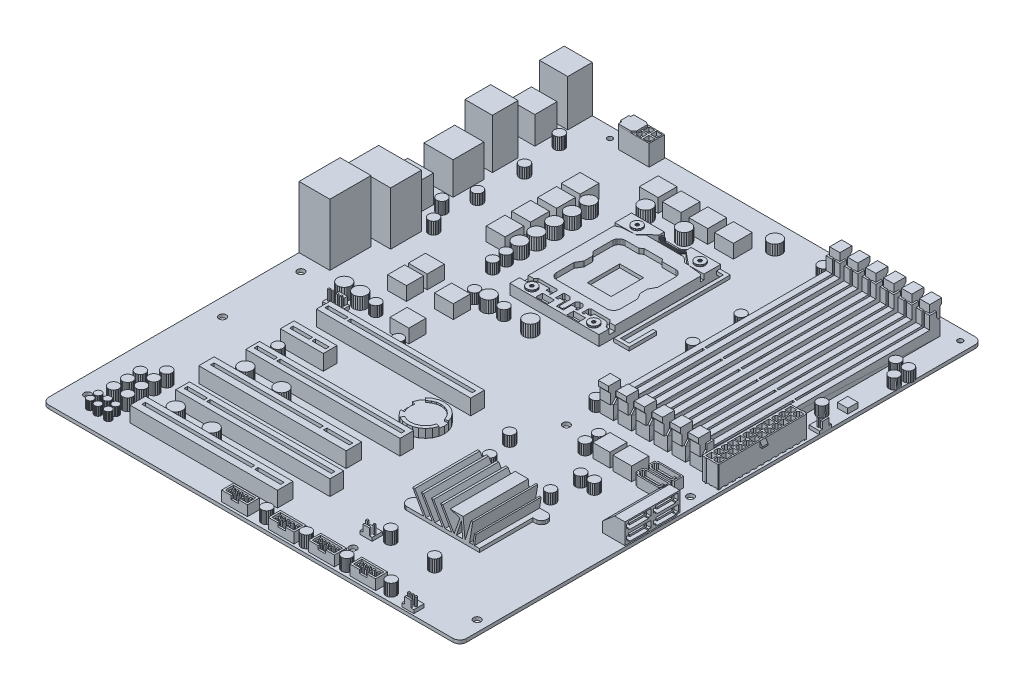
SolidWorks part; units mm, degrees
ref_plane "Front" through (0, 0, 0) normal (0, 0, 1) x (1, 0, 0)
ref_plane "Top" through (0, 0, 0) normal (0, 1, 0) x (1, 0, 0)
ref_plane "Right" through (0, 0, 0) normal (1, 0, 0) x (0, 0, -1)
imported_body "Imported1"
imported_body "Imported2"
imported_body "Imported3"
imported_body "Imported4"
imported_body "Imported5"
imported_body "Imported6"
imported_body "Imported7"
imported_body "Imported8"
imported_body "Imported9"
imported_body "Imported10"
imported_body "Imported11"
imported_body "Imported12"
imported_body "Surface-Imported4"
imported_body "Surface-Imported5"
imported_body "Surface-Imported6"
imported_body "Surface-Imported7"
imported_body "Surface-Imported20"
imported_body "Surface-Imported26"
imported_body "Surface-Imported27"
imported_body "Surface-Imported28"
imported_body "Surface-Imported29"
imported_body "Surface-Imported30"
imported_body "Surface-Imported31"
imported_body "Surface-Imported32"
imported_body "Surface-Imported33"
imported_body "Surface-Imported34"
imported_body "Surface-Imported35"
imported_body "Surface-Imported36"
imported_body "Surface-Imported37"
imported_body "Surface-Imported38"
imported_body "Surface-Imported39"
imported_body "Surface-Imported40"
imported_body "Surface-Imported41"
imported_body "Surface-Imported42"
imported_body "Surface-Imported43"
imported_body "Surface-Imported44"
imported_body "Surface-Imported45"
imported_body "Surface-Imported46"
imported_body "Surface-Imported47"
imported_body "Surface-Imported48"
imported_body "Surface-Imported49"
imported_body "Surface-Imported50"
imported_body "Surface-Imported51"
imported_body "Surface-Imported52"
imported_body "Surface-Imported53"
imported_body "Surface-Imported54"
imported_body "Surface-Imported55"
imported_body "Surface-Imported56"
imported_body "Surface-Imported57"
imported_body "Surface-Imported58"
imported_body "Surface-Imported59"
imported_body "Surface-Imported60"
imported_body "Surface-Imported61"
imported_body "Surface-Imported62"
imported_body "Surface-Imported63"
imported_body "Surface-Imported64"
imported_body "Surface-Imported65"
imported_body "Surface-Imported66"
imported_body "Surface-Imported67"
imported_body "Surface-Imported69"
imported_body "Surface-Imported70"
imported_body "Surface-Imported71"
imported_body "Surface-Imported72"
imported_body "Surface-Imported73"
imported_body "Surface-Imported74"
imported_body "Surface-Imported75"
imported_body "Surface-Imported76"
imported_body "Surface-Imported77"
imported_body "Surface-Imported78"
imported_body "Surface-Imported79"
imported_body "Surface-Imported80"
imported_body "Surface-Imported81"
imported_body "Surface-Imported82"
imported_body "Surface-Imported83"
imported_body "Surface-Imported84"
imported_body "Surface-Imported85"
imported_body "Surface-Imported86"
imported_body "Surface-Imported87"
imported_body "Surface-Imported88"
imported_body "Surface-Imported89"
imported_body "Surface-Imported90"
imported_body "Surface-Imported91"
imported_body "Surface-Imported92"
imported_body "Surface-Imported93"
imported_body "Surface-Imported94"
imported_body "Surface-Imported95"
imported_body "Surface-Imported96"
imported_body "Surface-Imported97"
imported_body "Surface-Imported98"
imported_body "Surface-Imported99"
imported_body "Surface-Imported100"
imported_body "Surface-Imported101"
imported_body "Surface-Imported102"
imported_body "Surface-Imported103"
imported_body "Surface-Imported104"
imported_body "Surface-Imported105"
imported_body "Surface-Imported106"
imported_body "Surface-Imported107"
imported_body "Surface-Imported108"
imported_body "Surface-Imported109"
imported_body "Surface-Imported110"
imported_body "Surface-Imported111"
imported_body "Surface-Imported112"
imported_body "Surface-Imported113"
imported_body "Surface-Imported114"
imported_body "Surface-Imported115"
imported_body "Surface-Imported116"
imported_body "Surface-Imported117"
imported_body "Surface-Imported118"
imported_body "Surface-Imported119"
imported_body "Surface-Imported120"
imported_body "Surface-Imported121"
imported_body "Surface-Imported122"
imported_body "Surface-Imported123"
imported_body "Surface-Imported124"
imported_body "Surface-Imported125"
imported_body "Surface-Imported126"
imported_body "Surface-Imported127"
imported_body "Surface-Imported128"
imported_body "Surface-Imported129"
imported_body "Surface-Imported130"
imported_body "Surface-Imported131"
imported_body "Surface-Imported132"
imported_body "Surface-Imported133"
imported_body "Surface-Imported134"
imported_body "Surface-Imported135"
imported_body "Surface-Imported136"
imported_body "Surface-Imported137"
imported_body "Surface-Imported138"
imported_body "Surface-Imported139"
imported_body "Surface-Imported140"
imported_body "Surface-Imported141"
imported_body "Surface-Imported142"
imported_body "Surface-Imported143"
imported_body "Surface-Imported144"
imported_body "Surface-Imported145"
imported_body "Surface-Imported146"
imported_body "Surface-Imported147"
imported_body "Surface-Imported148"
imported_body "Surface-Imported149"
imported_body "Surface-Imported150"
imported_body "Surface-Imported151"
imported_body "Surface-Imported152"
imported_body "Surface-Imported153"
imported_body "Surface-Imported154"
imported_body "Surface-Imported155"
imported_body "Surface-Imported156"
imported_body "Surface-Imported157"
imported_body "Surface-Imported158"
imported_body "Surface-Imported159"
imported_body "Surface-Imported160"
imported_body "Surface-Imported161"
imported_body "Surface-Imported162"
imported_body "Surface-Imported163"
imported_body "Surface-Imported164"
imported_body "Surface-Imported165"
imported_body "Surface-Imported166"
imported_body "Surface-Imported167"
surface "Surface-Plane1"
surface "Surface-Knit1"
surface "Surface-Plane2"
surface "Surface-Knit2"
surface "Surface-Plane3"
surface "Surface-Knit3"
surface "Surface-Plane4"
surface "Surface-Knit4"
surface "Surface-Plane5"
surface "Surface-Knit5"
surface "Surface-Plane6"
surface "Surface-Knit6"
surface "Surface-Plane7"
surface "Surface-Knit7"
surface "Surface-Plane8"
surface "Surface-Knit8"
surface "Surface-Plane9"
surface "Surface-Knit9"
surface "Surface-Plane10"
surface "Surface-Untrim1"
surface "Surface-Knit10"
surface "Surface-Plane11"
surface "Surface-Knit11"
surface "Surface-Knit12"
surface "Surface-Plane12"
surface "Surface-Knit13"
surface "Surface-Plane13"
surface "Surface-Knit14"
surface "Surface-Plane14"
surface "Surface-Knit15"
surface "Surface-Plane15"
surface "Surface-Knit16"
surface "Surface-Knit17"
pattern_linear "LPattern1" count 6 spacing 10.4927 along (-1, 0, 0)
imported_body "Surface-Imported1"
move or copy body "Body-Move/Copy8" bodies to move or copy 497 copy no translate (1114.9679, -426.0449, -345.9483)
move or copy body "Body-Move/Copy7" bodies to move or copy 498 placed by mates yes
other "Distance4" parameters "D1"=152.4
hole_wizard "#19 (0.166) Diameter Hole1" positions "Esquisse2" profile "Esquisse3" hole size "#19" standard "ANSI Inch"
sketch "Esquisse2" plane through (0, 2, 0) normal (0, 1, 0) x (-1, 0, 0)
  point P0 (-865.3533, -168.5039)
  point P4 (-865.3533, -247.2439)
  point P7 (-865.3533, -292.9639)
  point P10 (-888.2133, -447.9039)
  point P13 (-1020.2933, -447.9039)
  point P16 (-1092.6833, -447.9039)
  point P19 (-1020.2933, -292.9639)
  point P22 (-1092.6833, -292.9639)
  point P25 (-1020.2933, -244.7039)
  point P28 (-1020.2933, -168.5039)
  point P31 (-1092.6833, -168.5039)
sketch "Esquisse3" plane through (865.3533, 2, -168.5039) normal (1, 0, 0) x (0, 0, 1)
  line L0 (0, 0) -> (0, 4.3122)
  line L1 (0, 4.3122) -> (2.1082, 4.3122)
  line L2 (2.1082, 4.3122) -> (2.1082, 0)
  line L5 (2.1082, 0) -> (0, 0)
  line L11 (0, -6.35) -> (0, 107.95) construction
  dimension "Diamètre du perçage jusqu'au prochain" = 4.2164
  dimension "Profondeur du perçage jusqu'au prochain" = 4.3122
ref_plane "Plane1" through (0, 0, -304.3939) normal (0, 0, 1) x (1, 0, 0)
other "DeleteFace1"
hole_wizard "Ø3.0 (3) Diameter Hole1" positions "Sketch2" profile "Sketch1" hole size "Ø3.0" standard "ISO"
sketch "Sketch2" plane through (0, 2, 0) normal (0, 1, 0) x (1, 0, 0)
  circle A0 centre (865.3533, 168.5039) radius 2.1082 construction
  point P0 (888.2133, 450.4439)
  point P5 (1020.2933, 450.4439)
  point P8 (1092.6833, 450.4439)
  dimension "D1" = 281.94
  dimension "D2" = 22.86
  dimension "D3" = 132.08
sketch "Sketch1" plane through (888.2133, 2, -450.4439) normal (1, 0, 0) x (0, 0, 1)
  line L0 (0, 0) -> (0, 3.9493)
  line L1 (0, 3.9493) -> (1.5, 3.048)
  line L2 (1.5, 3.048) -> (1.5, 0)
  line L5 (1.5, 0) -> (0, 0)
  line L10 (0, 3.9493) -> (-1.5, 3.048) construction
  line L11 (0, -6.35) -> (0, 107.95) construction
  dimension "Hole Dia." = 3
  dimension "Hole Depth" = 3.048
  dimension "Drill Angle" = 118
